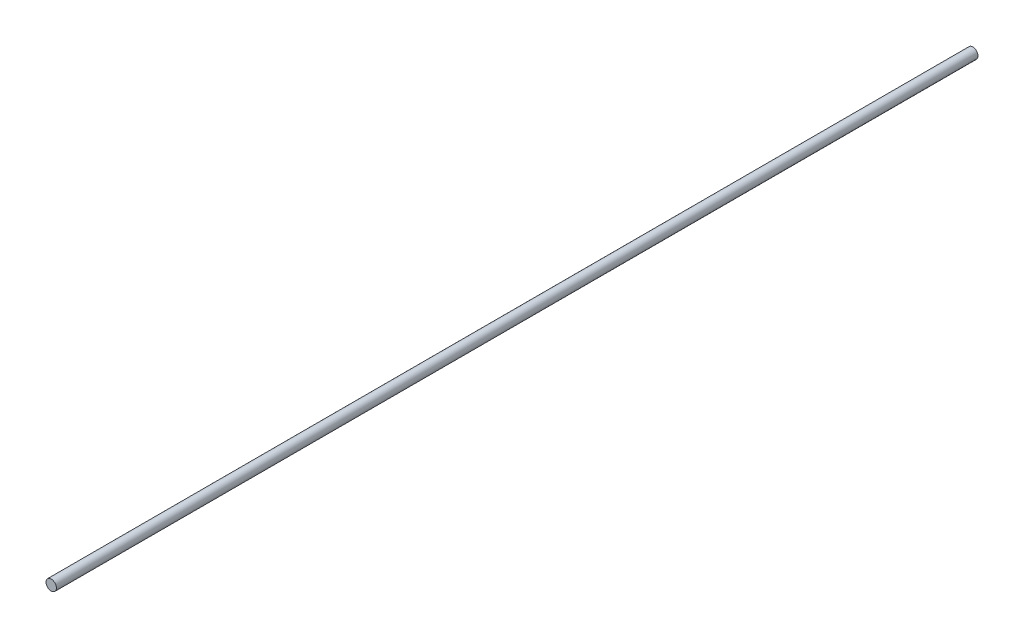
SolidWorks part; units mm, degrees
ref_plane "Front Plane" through (0, 0, 0) normal (0, 0, 1) x (1, 0, 0)
ref_plane "Top Plane" through (0, 0, 0) normal (0, 1, 0) x (1, 0, 0)
ref_plane "Right Plane" through (0, 0, 0) normal (1, 0, 0) x (0, 0, -1)
sketch "Sketch1" plane through (0, 0, 0) normal (0, 0, 1) x (1, 0, 0)
  circle A0 centre (0, 0) radius 30
  dimension "D1" = 60
extrude "Boss-Extrude1" add sketch "Sketch1" against normal blind 5300
